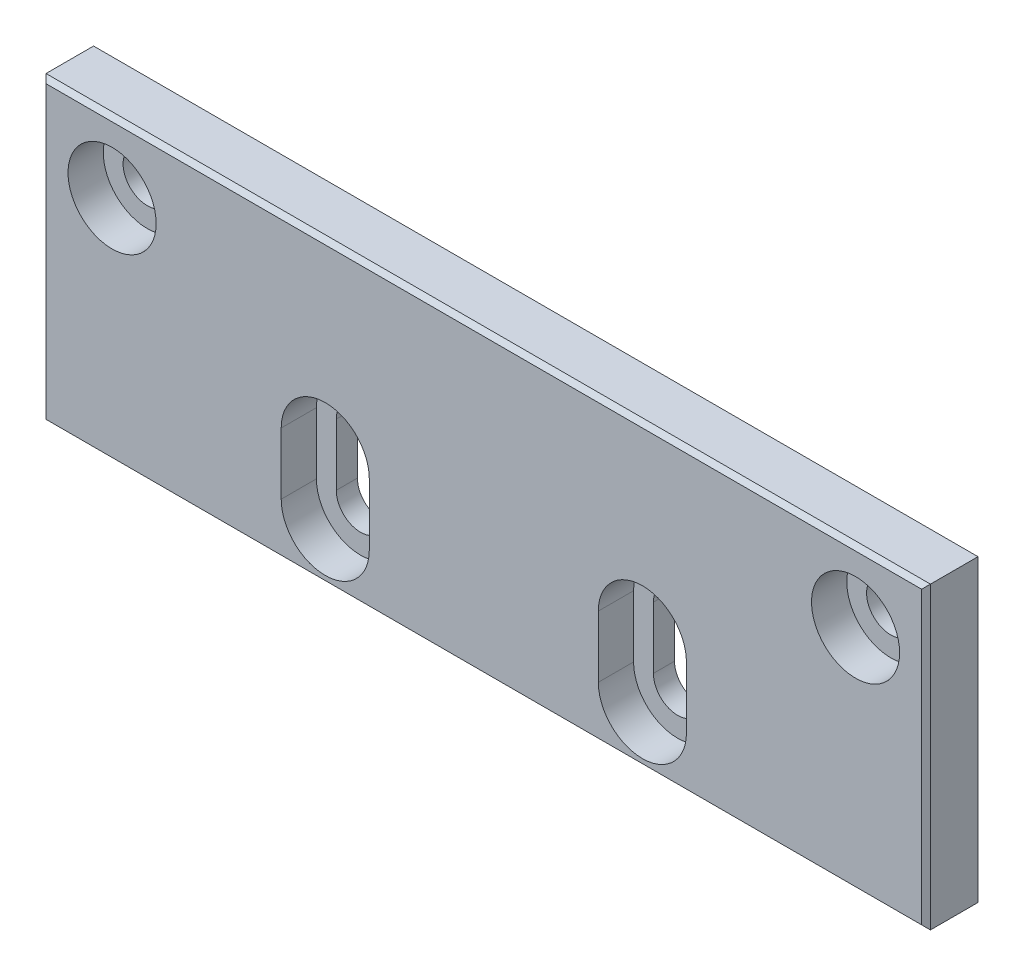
SolidWorks part; units mm, degrees
ref_plane "Plan de face" through (0, 0, 0) normal (0, 0, 1) x (1, 0, 0)
ref_plane "Plan de dessus" through (0, 0, 0) normal (0, 1, 0) x (1, 0, 0)
ref_plane "Plan de droite" through (0, 0, 0) normal (1, 0, 0) x (0, 0, -1)
sketch "Esquisse1" plane through (0, 0, 0) normal (0, 0, 1) x (1, 0, 0)
  line L1 (0, -36.8656) -> (0, 6.656) construction
  line L3 (-78, -27) -> (-78, 0) construction
  line L4 (78, 0) -> (78, -27) construction
  line L5 (-14.5, -9) -> (-4.5, -9) construction
  line L6 (50.2, -45) -> (-50.2, -45)
  line L7 (50.2, -45) -> (50.2, -11)
  line L8 (50.2, -11) -> (-50.2, -11)
  line L9 (-50.2, -45) -> (-50.2, -11)
  line L11 (78, -27) -> (-78, -27) construction
  dimension "D1" = 100.4
  dimension "D2" = 2
  dimension "D3" = 18
extrude "Extrusion1" add sketch "Esquisse1" along normal blind 6.4
chamfer "Chanfrein1" distance 0.5 angle 45 8 edges at (0, -11, 0) (-50.2, -28, 0) (0, -45, 0) (50.2, -28, 0) (0, -45, 6.4) (-50.2, -28, 6.4) (0, -11, 6.4) (50.2, -28, 6.4)
hole_wizard "Chambrage pour vis à tête cylindrique à 6 pans creux (ou vis CHC) M51" positions "Esquisse3" profile "Esquisse2" counterbore size "M5" standard "Ansi Métrique"
sketch "Esquisse3" plane through (0, 0, 6.4) normal (0, 0, 1) x (1, 0, 0)
  line L0 (-50.2, -45) -> (-50.2, -11) construction
  line L3 (-46.2709, -19) -> (-33.0166, -19) construction
  line L4 (78, -27) -> (-78, -27) construction
  line L5 (-50.2, -11) -> (50.2, -11) construction
  line L6 (50.2, -11) -> (50.2, -45) construction
  line L7 (0, -53.2744) -> (0, 2.7426) construction
  line L8 (78, -27) -> (-78, -27) construction
  point P0 (42.2, -19)
  point P1 (-42.2, -19)
  dimension "D1" = 8
  dimension "D2" = 8
sketch "Esquisse2" plane through (42.2, -19, 6.4) normal (1, 0, 0) x (0, -1, 0)
  line L0 (0, 0) -> (0, 6.4)
  line L1 (0, 6.4) -> (2.75, 6.4)
  line L3 (2.75, 6.4) -> (2.75, 4)
  line L4 (2.75, 4) -> (5, 4)
  line L5 (5, 4) -> (5, 0)
  line L7 (5, 0) -> (0, 0)
  line L11 (0, -6.35) -> (0, 107.95) construction
  dimension "Diamètre du perçage jusqu'au prochain" = 5.5
  dimension "Profondeur du perçage jusqu'au prochain" = 6.4
  dimension "Diamètre du chambrage" = 10
  dimension "Profondeur du chambrage" = 4
sketch "Esquisse4" plane through (0, 0, 6.4) normal (0, 0, 1) x (1, 0, 0)
  line L0 (0, 2.4374) -> (0, -61.7299) construction
  line L1 (18, -21.3743) -> (18, -42.9785) construction
  line L2 (13, -32) -> (13, -39)
  line L3 (23, -32) -> (23, -39)
  line L4 (78, -27) -> (-78, -27) construction
  line L5 (78, -27) -> (-78, -27) construction
  line L6 (50.2, -45) -> (-50.2, -45) construction
  line L7 (-18, -21.3743) -> (-18, -42.9785) construction
  line L8 (-23, -32) -> (-23, -39)
  line L9 (-13, -32) -> (-13, -39)
  circle A0 centre (42.2, -19) radius 5 construction
  circle A1 centre (-42.2, -19) radius 5 construction
  arc A2 (-13, -39) -> (-23, -39) centre (-18, -39) cw
  arc A3 (23, -32) -> (13, -32) centre (18, -32) ccw
  arc A4 (13, -39) -> (23, -39) centre (18, -39) ccw
  arc A5 (-23, -32) -> (-13, -32) centre (-18, -32) cw
  dimension "D1" = 10
  dimension "D2" = 6
  dimension "D3" = 5
  dimension "D4" = 18
extrude "Enlèv. mat.-Extru.1" cut sketch "Esquisse4" against normal blind 4
sketch "Esquisse5" plane through (0, 0, 2.4) normal (0, 0, 1) x (1, 0, 0)
  line L2 (0, -14.3883) -> (0, -45.6221) construction
  line L3 (13, -32) -> (13, -39) construction
  line L4 (15.25, -32) -> (15.25, -39)
  line L5 (20.75, -39) -> (20.75, -32)
  line L6 (15.25, -32) -> (15.25, -39)
  line L7 (20.75, -39) -> (20.75, -32)
  line L8 (-13, -39) -> (-13, -32) construction
  line L9 (-20.75, -39) -> (-20.75, -32)
  line L10 (-15.25, -32) -> (-15.25, -39)
  arc A2 (-15.25, -39) -> (-20.75, -39) centre (-18, -39) cw
  arc A3 (-20.75, -32) -> (-15.25, -32) centre (-18, -32) cw
  arc A4 (20.75, -32) -> (15.25, -32) centre (18, -32) ccw
  arc A5 (15.25, -39) -> (20.75, -39) centre (18, -39) ccw
  arc A6 (20.75, -32) -> (15.25, -32) centre (18, -32) ccw
  arc A7 (15.25, -39) -> (20.75, -39) centre (18, -39) ccw
  dimension "D1" = 2.25
extrude "Enlèv. mat.-Extru.2" cut sketch "Esquisse5" against normal through all
